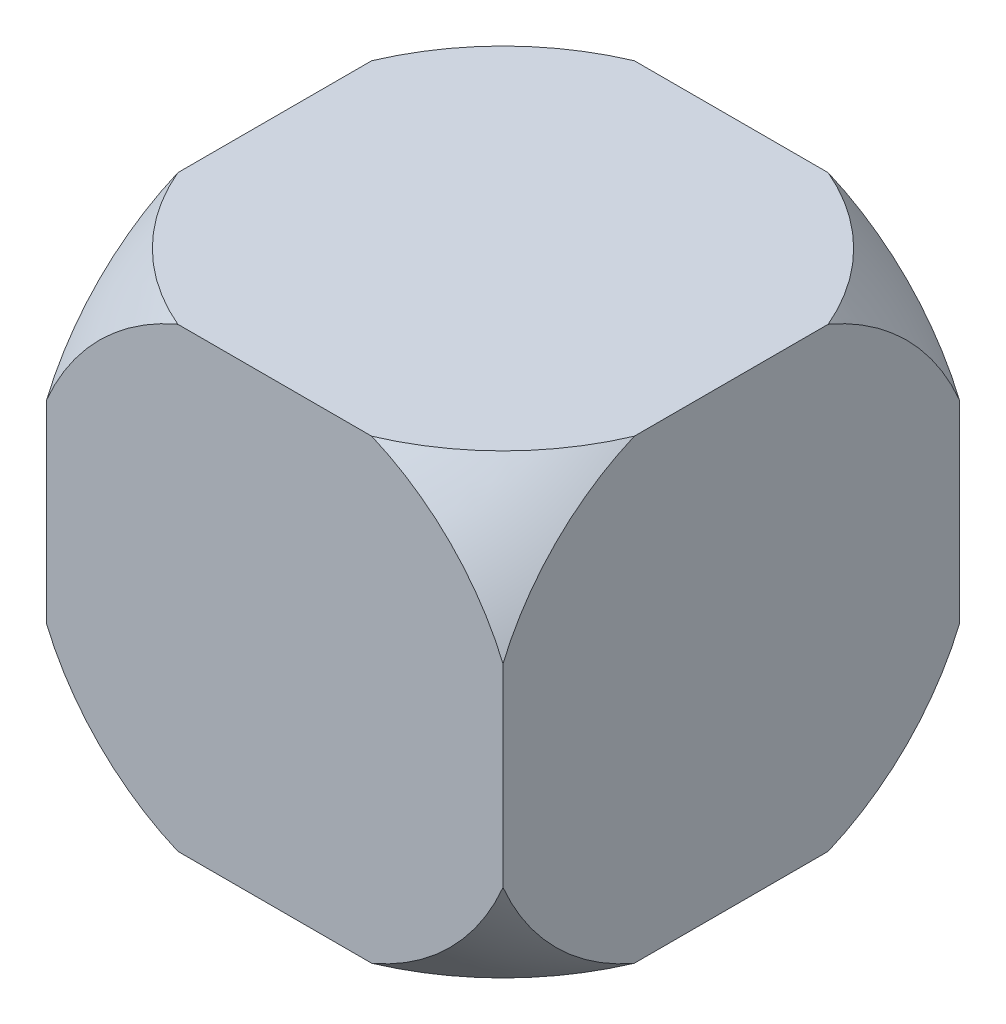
SolidWorks part; units mm, degrees
ref_plane "TOP" through (0, 0, 0) normal (0, 0, 1) x (1, 0, 0)
ref_plane "FRONT" through (0, 0, 0) normal (0, 1, 0) x (1, 0, 0)
ref_plane "RIGHT" through (0, 0, 0) normal (1, 0, 0) x (0, 0, -1)
sketch "Skizze1" plane through (0, 0, 0) normal (0, 0, 1) x (1, 0, 0)
  line L1 (-25, 25) -> (25, 25)
  line L2 (-25, 25) -> (-25, -25)
  line L3 (-25, -25) -> (25, -25)
  line L4 (25, 25) -> (25, -25)
  dimension "D1" = 25
  dimension "D2" = 50
  dimension "D3" = 25
  dimension "D4" = 50
extrude "Linear austragen1" add sketch "Skizze1" along normal blind 50
ref_plane "Ebene1" through (0, 0, 25) normal (0, 0, 1) x (1, 0, 0)
sketch "Skizze6" plane through (0, 0, 25) normal (0, 0, 1) x (1, 0, 0)
  line L0 (0, 0) -> (0, 57.9366) construction
  line L1 (0, 0) -> (0, -62.1436) construction
  line L2 (0, 36.9148) -> (0, 53.5315)
  line L3 (0, -36.9148) -> (0, -53.5315)
  arc A0 (0, -36.9148) -> (0, 36.9148) centre (0, 0) ccw
  arc A1 (0, -53.5315) -> (0, 53.5315) centre (0, 0) ccw
revolve "Schnitt-Rotation1" cut sketch "Skizze6" angle 360 about L0
